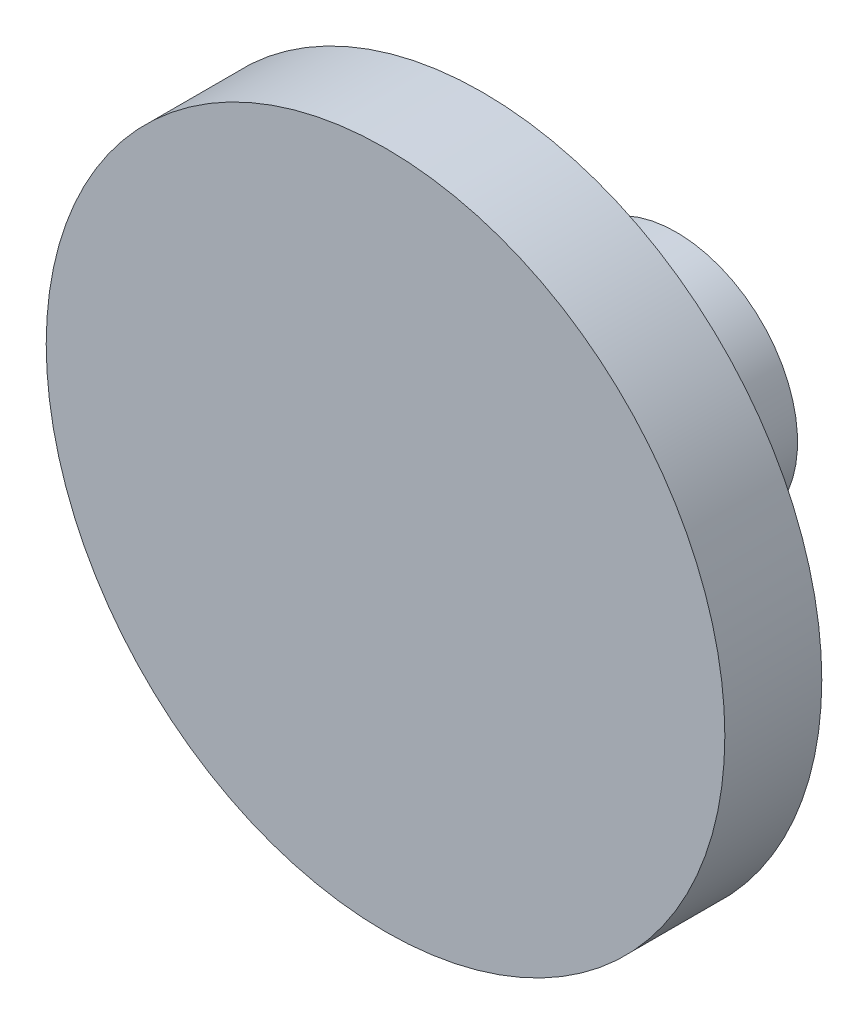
SolidWorks part; units mm, degrees
ref_plane "Спереди" through (0, 0, 0) normal (0, 0, 1) x (1, 0, 0)
ref_plane "Сверху" through (0, 0, 0) normal (0, 1, 0) x (1, 0, 0)
ref_plane "Справа" through (0, 0, 0) normal (1, 0, 0) x (0, 0, -1)
ref_plane "Плоскость1" through (0, 0, 0) normal (0, -1, 0) x (1, 0, 0)
sketch "Эскиз1" plane through (0, 0, 0) normal (0, -1, 0) x (1, 0, 0)
  line L0 (21, -3) -> (0, -3)
  line L1 (0, -3) -> (0, -9)
  line L2 (0, -9) -> (21, -9)
  line L3 (21, -9) -> (21, -3)
  line L4 (0, -3) -> (0, -9) construction
revolve "Повернуть1" add sketch "Эскиз1" angle 360 about L4
sketch "Эскиз3" plane through (0, 0, -9) normal (0, 0, -1) x (-1, 0, 0)
  circle A0 centre (0, 0) radius 7.5
extrude "Бобышка-Вытянуть2" add sketch "Эскиз3" along normal blind 12
hole_wizard "Отверстие обработанное метчиком M61" positions "Трехмерный эскиз1" profile "Эскиз4" tap size "M6" standard "GOST"
sketch3d "Трехмерный эскиз1"
  point P0 (5.965, -4.5463, -16.4753)
sketch "Эскиз4" plane through (5.965, -4.5463, -16.4753) normal (0, 0, 1) x (0.6062, 0.7953, 0)
  line L0 (0, 0) -> (0, 18.5202)
  line L1 (0, 18.5202) -> (2.5, 17.018)
  line L2 (2.5, 17.018) -> (2.5, 0)
  line L5 (2.5, 0) -> (0, 0)
  line L10 (0, 18.5202) -> (-2.5, 17.018) construction
  line L11 (0, -6.35) -> (0, 107.95) construction
  dimension "Диаметр сверла" = 5
  dimension "Глубина сверла" = 17.018
  dimension "Угол заточки сверла" = 118
